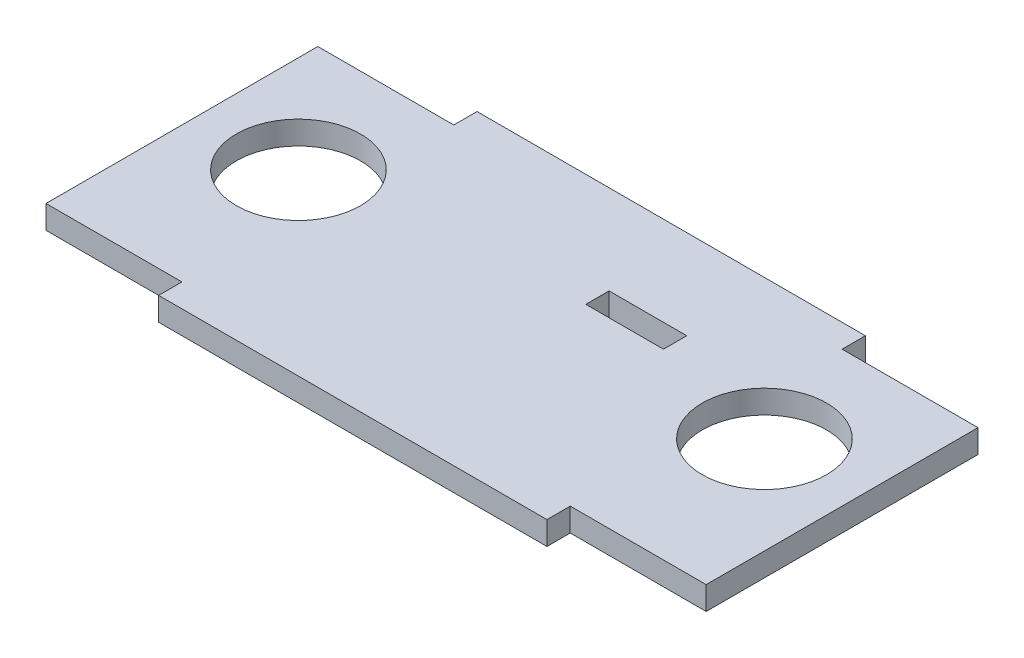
SolidWorks part; units mm, degrees
ref_plane "Front Plane" through (0, 0, 0) normal (0, 0, 1) x (1, 0, 0)
ref_plane "Top Plane" through (0, 0, 0) normal (0, 1, 0) x (1, 0, 0)
ref_plane "Right Plane" through (0, 0, 0) normal (1, 0, 0) x (0, 0, -1)
sketch "Sketch1" plane through (0, 0, 0) normal (0, 1, 0) x (1, 0, 0)
  line L1 (-42.5, 25) -> (42.5, 25)
  line L2 (-42.5, 25) -> (-42.5, -25)
  line L3 (-42.5, -25) -> (42.5, -25)
  line L4 (42.5, 25) -> (42.5, -25)
  line L5 (-42.5, 25) -> (42.5, -25) construction
  line L6 (-42.5, -25) -> (42.5, 25) construction
  point P0 (0, 0)
  dimension "D1" = 85
  dimension "D2" = 50
extrude "Boss-Extrude1" add sketch "Sketch1" along normal blind 3
sketch "Sketch2" plane through (0, 3, 0) normal (0, 1, 0) x (1, 0, 0)
  line L1 (-30, 7) -> (30, 7) construction
  line L2 (42.5, 25) -> (-42.5, 25) construction
  line L3 (0, -1.65) -> (0, 1.65) construction
  circle A0 centre (-30, 7) radius 8
  circle A1 centre (30, 7) radius 8
  dimension "D4" = 16
  dimension "D1" = 18
  dimension "D2" = 30
  dimension "D3" = 30
extrude "Cut-Extrude1" cut sketch "Sketch2" against normal blind 3
sketch "Sketch4" plane through (0, 3, 0) normal (0, 1, 0) x (1, 0, 0)
  line L0 (-42.5, -25) -> (42.5, -25) construction
  line L1 (0, -25) -> (-16.5, -25)
  line L2 (0, -25) -> (0, -16)
  line L3 (0, -16) -> (-16.5, -16)
  line L4 (-16.5, -25) -> (-16.5, -16)
  dimension "D1" = 9
  dimension "D2" = 16.5
extrude "Cut-Extrude2" cut sketch "Sketch4" against normal blind 3
mirror "Mirror1" about plane through (0, 0, 0) normal (1, 0, 0) of "Cut-Extrude2"
sketch "Sketch6" plane through (0, 3, 0) normal (0, 1, 0) x (1, 0, 0)
  line L0 (16.5, -16) -> (-16.5, -16) construction
  line L1 (-5, -16) -> (5, -16)
  line L2 (-5, -16) -> (-5, -28)
  line L3 (-5, -28) -> (5, -28)
  line L4 (5, -16) -> (5, -28)
  line L5 (0, -1.65) -> (0, 1.65) construction
  dimension "D1" = 10
  dimension "D2" = 12
  dimension "D3" = 5
extrude "Boss-Extrude2" add sketch "Sketch6" against normal blind 3 contours L2 L3 L4 L1
sketch "Sketch7" plane through (0, 3, 0) normal (0, 1, 0) x (1, 0, 0)
  line L0 (42.5, -25) -> (42.5, 25) construction
  line L1 (3.5, 13.5) -> (13.5, 13.5)
  line L2 (3.5, 13.5) -> (3.5, 10.5)
  line L3 (3.5, 10.5) -> (13.5, 10.5)
  line L4 (13.5, 13.5) -> (13.5, 10.5)
  line L5 (3.5, 13.5) -> (13.5, 10.5) construction
  line L6 (3.5, 10.5) -> (13.5, 13.5) construction
  line L7 (42.5, 25) -> (-42.5, 25) construction
  point P0 (8.5, 12)
  dimension "D1" = 34
  dimension "D2" = 13
  dimension "D3" = 10
  dimension "D4" = 3
extrude "Cut-Extrude3" cut sketch "Sketch7" against normal blind 3
sketch "Sketch8" plane through (0, 3, 0) normal (0, 1, 0) x (1, 0, 0)
  line L1 (-42.5, -31.1021) -> (47.2095, -31.1021)
  line L2 (-42.5, -31.1021) -> (-42.5, -16)
  line L3 (-42.5, -16) -> (47.2095, -16)
  line L4 (47.2095, -31.1021) -> (47.2095, -16)
extrude "Cut-Extrude4" cut sketch "Sketch8" against normal blind 10
sketch "Sketch9" plane through (0, 3, 0) normal (0, 1, 0) x (1, 0, 0)
  line L1 (-42.5, 25) -> (-25, 25)
  line L2 (-42.5, 25) -> (-42.5, 22)
  line L3 (-42.5, 22) -> (-25, 22)
  line L4 (-25, 25) -> (-25, 22)
  dimension "D1" = 17.5
  dimension "D2" = 3
extrude "Cut-Extrude5" cut sketch "Sketch9" against normal blind 3
mirror "Mirror2" about plane through (0, 0, 0) normal (1, 0, 0) of "Cut-Extrude5"
sketch "Sketch10" plane through (0, 3, 0) normal (0, 1, 0) x (1, 0, 0)
  line L1 (-42.5, -16) -> (-25, -16)
  line L2 (-42.5, -16) -> (-42.5, -13)
  line L3 (-42.5, -13) -> (-25, -13)
  line L4 (-25, -16) -> (-25, -13)
  dimension "D1" = 17.5
  dimension "D2" = 3
extrude "Cut-Extrude6" cut sketch "Sketch10" against normal blind 3
mirror "Mirror3" about plane through (0, 0, 0) normal (1, 0, 0) of "Cut-Extrude6"
